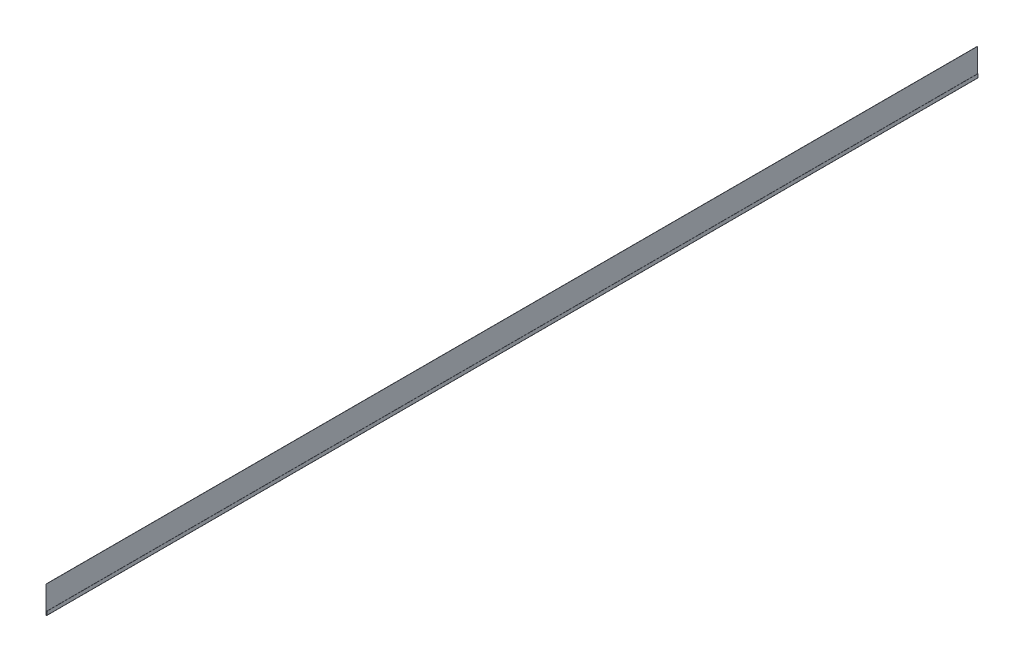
SolidWorks part; units mm, degrees
ref_plane "Front" through (0, 0, 0) normal (0, 0, 1) x (1, 0, 0)
ref_plane "Top" through (0, 0, 0) normal (0, 1, 0) x (1, 0, 0)
ref_plane "Right" through (0, 0, 0) normal (1, 0, 0) x (0, 0, -1)
sketch "Sketch1" plane through (0, 0, 0) normal (0, 0, 1) x (1, 0, 0)
  line L0 (0, 1.27) -> (0, 88.9)
  line L1 (1, 0) -> (0.27, 0) construction
  line L2 (2.54, 1.27) -> (2.54, 12.7)
  arc A0 (0, 1.27) -> (2.54, 1.27) centre (1.27, 1.27) ccw
  point P15 (2.54, 0)
  point P18 (0, 0)
  dimension "D3" = 12.7
  dimension "D1" = 88.9
  dimension "D2" = 2.54
extrude "Extrude-Thin1" add sketch "Sketch1" along normal blind 3048 thin
